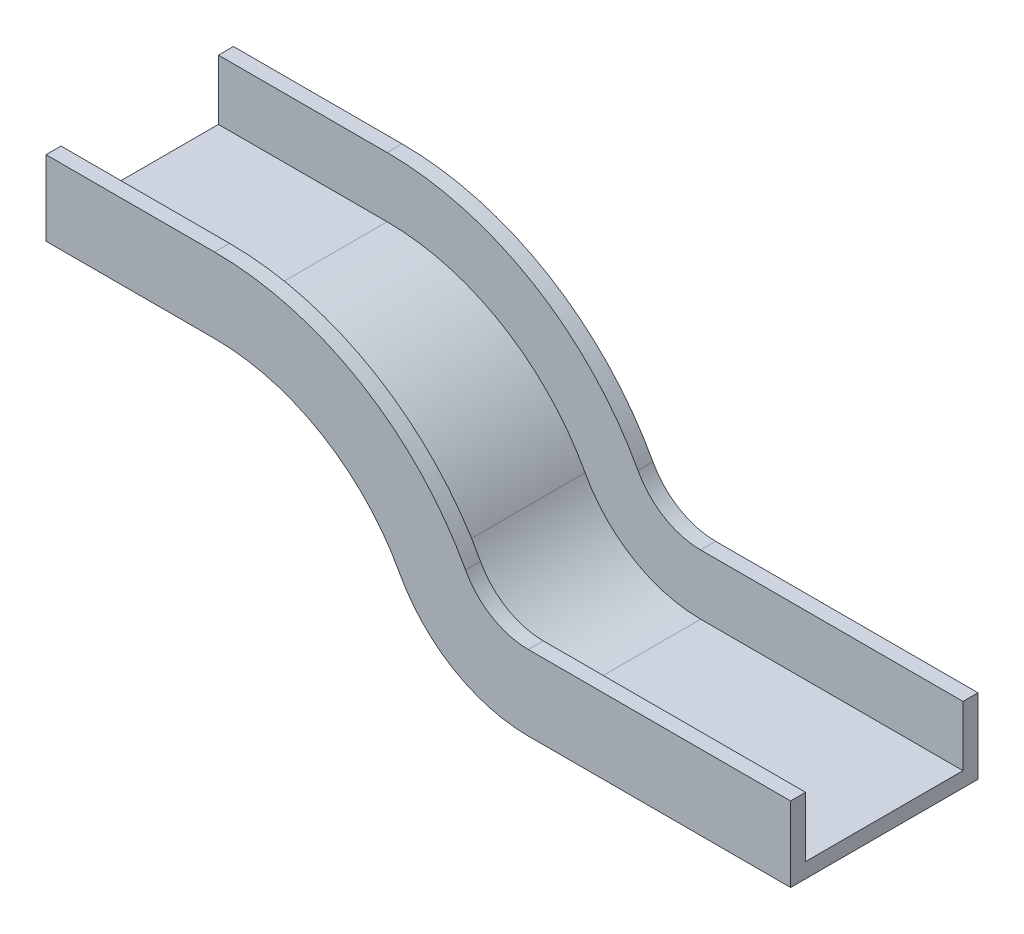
SolidWorks part; units mm, degrees
ref_plane "Front Plane" through (0, 0, 0) normal (0, 0, 1) x (1, 0, 0)
ref_plane "Top Plane" through (0, 0, 0) normal (0, 1, 0) x (1, 0, 0)
ref_plane "Right Plane" through (0, 0, 0) normal (1, 0, 0) x (0, 0, -1)
sketch "Sketch1" plane through (0, 0, 0) normal (0, 0, 1) x (1, 0, 0)
  line L0 (0, 0) -> (45, 0)
  line L2 (128.666, -50) -> (198.666, -50)
  arc A0 (45, 0) -> (97.8417, -31.5789) centre (45, -60) cw
  arc A1 (97.8417, -31.5789) -> (128.666, -50) centre (128.666, -15) ccw
  dimension "D2" = 35
  dimension "D3" = 60
  dimension "D1" = 45
  dimension "D4" = 70
  dimension "D5" = 50
sketch "Sketch2" plane through (0, 0, 0) normal (1, 0, 0) x (0, 0, -1)
  line L0 (21, 0) -> (-21, 0)
  line L1 (-21, 0) -> (-21, 16)
  line L2 (-21, 16) -> (-25, 16)
  line L3 (0, 0) -> (0, 38.8319) construction
  line L4 (-25, 16) -> (-25, -4)
  line L5 (25, 16) -> (25, -4)
  line L6 (21, 16) -> (25, 16)
  line L7 (21, 0) -> (21, 16)
  line L8 (-25, -4) -> (25, -4)
  dimension "D4" = 4
  dimension "D1" = 4
  dimension "D2" = 20
  dimension "D3" = 50
sweep "Sweep1" add profiles "Sketch2" path "Sketch1"
